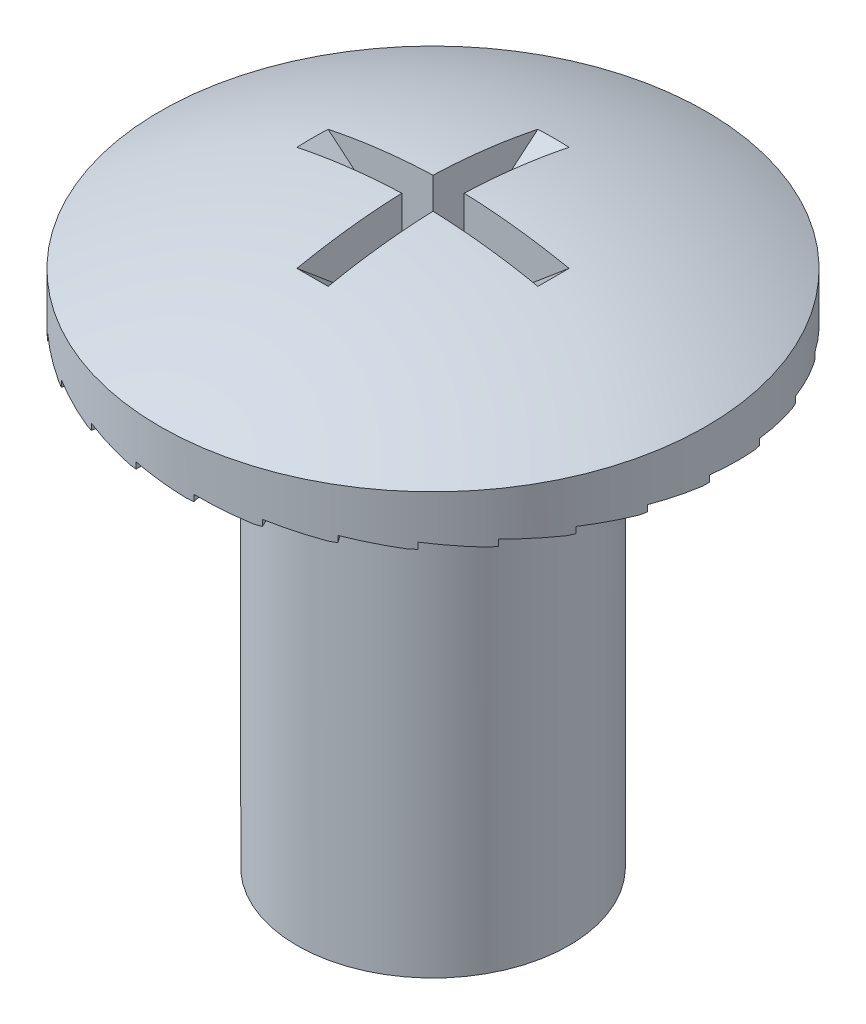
SolidWorks part; units mm, degrees
ref_plane "Front Plane" through (0, 0, 0) normal (0, 0, 1) x (1, 0, 0)
ref_plane "Top Plane" through (0, 0, 0) normal (0, 1, 0) x (1, 0, 0)
ref_plane "Right Plane" through (0, 0, 0) normal (1, 0, 0) x (0, 0, -1)
sketch "Sketch1" plane through (0, 0, 0) normal (0, 0, 1) x (1, 0, 0)
  line L0 (0, 0) -> (0, -14.8868) construction
  line L1 (5.5562, -1.3462) -> (5.5562, -2.3622)
  line L2 (5.5562, -2.3622) -> (2.7686, -2.3622)
  line L3 (2.7686, -2.3622) -> (2.7686, -11.8872)
  line L4 (2.7686, -11.8872) -> (0, -11.8872)
  line L5 (0, 0) -> (0, -11.8872)
  arc A0 (0, 0) -> (5.5562, -1.3462) centre (-0.1356, -12.6993) cw
  dimension "D5" = 12.7
  dimension "D1" = 5.5372
  dimension "D2" = 11.1125
  dimension "D3" = 2.3622
  dimension "D4" = 1.016
  dimension "D6" = 9.525
revolve "Revolve1" add sketch "Sketch1" angle 360 about L0
hole_wizard "#8 Clearance Hole1" positions "Sketch4" profile "Sketch3" hole size "#8" standard "Ansi Inch"
sketch "Sketch4" plane through (0, -11.8872, 0) normal (0, -1, 0) x (1, 0, 0)
  point P0 (0, 0)
sketch "Sketch3" plane through (0, -11.8872, 0) normal (1, 0, 0) x (0, 0, -1)
  line L0 (0, 0) -> (0, 7.7007)
  line L1 (0, 7.7007) -> (2.2479, 6.35)
  line L2 (2.2479, 6.35) -> (2.2479, 0)
  line L5 (2.2479, 0) -> (0, 0)
  line L10 (0, 7.7007) -> (-2.2479, 6.35) construction
  line L11 (0, -6.35) -> (0, 107.95) construction
  dimension "Hole Dia." = 4.4958
  dimension "Hole Depth" = 6.35
  dimension "Drill Angle" = 118
sketch "Sketch5" plane through (0, 0, 0) normal (0, 0, 1) x (1, 0, 0)
  line L0 (0, 1.0843) -> (0, -3.3305) construction
  line L1 (0, -1.8894) -> (0.5215, -1.8894)
  line L2 (0.5215, -1.8894) -> (2.8026, 0.0247)
  line L3 (2.8026, 0.0247) -> (0, 0.0247)
  line L4 (0, 0.0247) -> (0, -1.8894)
  dimension "D1" = 0.5215
  dimension "D2" = 140
  dimension "D3" = 1.9141
  dimension "D4" = 0.0247
extrude "Cut-Extrude2" cut sketch "Sketch5" against normal mid plane 0.635
pattern_circular "CirPattern1" count 4 over 360 about axis through (0, 0, 0) along (0, 1, 0) of "Cut-Extrude2"
ref_plane "Plane2" through (0, 0, 5.588) normal (0, 0, 1) x (1, 0, 0)
sketch "Sketch8" plane through (0, 0, 5.588) normal (0, 0, 1) x (1, 0, 0)
  line L0 (0.508, -2.3622) -> (-0.508, -2.2352)
  line L1 (-2.7686, -2.3622) -> (2.7686, -2.3622) construction
  line L2 (-0.508, -2.2352) -> (-0.508, -2.3622)
  line L3 (-0.508, -2.3622) -> (0.508, -2.3622)
  point P4 (0, -2.2987)
  dimension "D1" = 0.127
  dimension "D2" = 1.016
extrude "Cut-Extrude4" cut sketch "Sketch8" against normal up to surface (2.8664 mm away)
pattern_circular "CirPattern2" count 30 over 360 about axis through (0, 0, 0) along (0, 1, 0) of "Cut-Extrude4"
